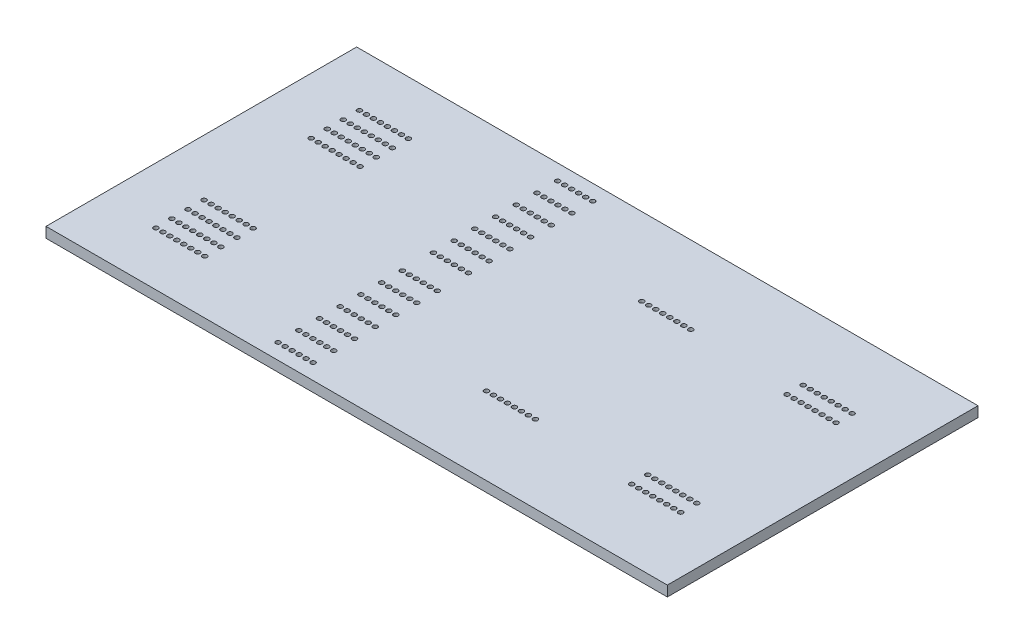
SolidWorks part; units mm, degrees
ref_plane "Plan de face" through (0, 0, 0) normal (0, 0, 1) x (1, 0, 0)
ref_plane "Plan de dessus" through (0, 0, 0) normal (0, 1, 0) x (1, 0, 0)
ref_plane "Plan de droite" through (0, 0, 0) normal (1, 0, 0) x (0, 0, -1)
sketch "Esquisse2" plane through (0, 0, 0) normal (0, 1, 0) x (1, 0, 0)
  line L1 (-60, -15) -> (60, -15)
  line L2 (-60, -15) -> (-60, 15)
  line L3 (-60, 15) -> (60, 15)
  line L4 (60, -15) -> (60, 15)
  line L5 (-60, -15) -> (60, 15) construction
  line L6 (-60, 15) -> (60, -15) construction
  point P0 (0, 0)
  dimension "D1" = 30
  dimension "D2" = 120
extrude "Boss.-Extru.1" add sketch "Esquisse2" along normal blind 2 contours L3 L4 L1 L2
sketch "Cavités" plane through (0, 0, 0) normal (0, 1, 0) x (1, 0, 0)
  line L0 (-60, -15) -> (60, -15) construction
  line L1 (-58.4, 15) -> (-30.4, 15) construction
  line L2 (-58.4, 15) -> (-58.4, -15) construction
  line L3 (-58.4, -15) -> (-30.4, -15) construction
  line L4 (-30.4, 15) -> (-30.4, -15) construction
  line L5 (-60, 15) -> (60, 15) construction
  line L6 (-28.8, 15) -> (-0.8, 15) construction
  line L7 (-28.8, 15) -> (-28.8, -15) construction
  line L8 (-28.8, -15) -> (-0.8, -15) construction
  line L9 (-0.8, 15) -> (-0.8, -15) construction
  line L10 (-30.4, 15) -> (-28.8, 15) construction
  line L11 (0.8, 15) -> (28.8, 15) construction
  line L12 (0.8, 15) -> (0.8, -15) construction
  line L13 (0.8, -15) -> (28.8, -15) construction
  line L14 (28.8, 15) -> (28.8, -15) construction
  line L15 (30.4, 15) -> (58.4, 15) construction
  line L16 (30.4, 15) -> (30.4, -15) construction
  line L17 (30.4, -15) -> (58.4, -15) construction
  line L18 (58.4, 15) -> (58.4, -15) construction
  line L19 (-0.8, 15) -> (0.8, 15) construction
  line L20 (28.8, 15) -> (30.4, 15) construction
  line L21 (-60, 15) -> (-58.4, 15) construction
  line L22 (58.4, 15) -> (60, 15) construction
  dimension "D1" = 28
  dimension "D2" = 1.6
sketch "Esquisse7" plane through (0, 2, 0) normal (0, 1, 0) x (1, 0, 0)
  line L0 (-58.4, 0) -> (-49.125, 0) construction
  line L1 (-49.125, 4.6665) -> (-39.675, 4.6665) construction
  line L2 (-49.125, 4.6665) -> (-49.125, -4.6665) construction
  line L3 (-49.125, -4.6665) -> (-39.675, -4.6665) construction
  line L4 (-39.675, 4.6665) -> (-39.675, -4.6665) construction
  line L5 (-58.4, 15) -> (-58.4, -15) construction
  line L6 (-39.675, 0) -> (-30.4, 0) construction
  line L7 (-30.4, 15) -> (-30.4, -15) construction
  dimension "D1" = 9.45
  dimension "D2" = 9.333
sketch "Esquisse8" plane through (0, 2, 0) normal (0, 1, 0) x (1, 0, 0)
  circle A0 centre (-49.125, 4.6665) radius 0.45
  dimension "D1" = 0.9
extrude "Enlèv. mat.-Extru.3" cut sketch "Esquisse8" against normal up to next
pattern_linear "Répétition linéaire4" count 8 spacing 1.35 along (1, 0, 0) count 4 spacing 3.111 along (0, 0, 1) of "Enlèv. mat.-Extru.3"
sketch "Esquisse9" plane through (0, 2, 0) normal (0, 1, 0) x (1, 0, 0)
  line L0 (-28.8, 0) -> (-18.175, 0) construction
  line L1 (-18.175, 12) -> (-11.425, 12) construction
  line L2 (-18.175, 12) -> (-18.175, -12) construction
  line L3 (-18.175, -12) -> (-11.425, -12) construction
  line L4 (-11.425, 12) -> (-11.425, -12) construction
  line L5 (-28.8, 15) -> (-28.8, -15) construction
  line L6 (-11.425, 0) -> (-0.8, 0) construction
  line L7 (-0.8, 15) -> (-0.8, -15) construction
  dimension "D1" = 6.75
  dimension "D2" = 24
sketch "Esquisse10" plane through (0, 2, 0) normal (0, 1, 0) x (1, 0, 0)
  circle A0 centre (-18.175, 12) radius 0.45
  dimension "D1" = 0.9
extrude "Enlèv. mat.-Extru.4" cut sketch "Esquisse10" against normal up to next
pattern_linear "Répétition linéaire5" count 6 spacing 1.35 along (1, 0, 0) count 7 spacing 4 along (0, 0, 1) of "Enlèv. mat.-Extru.4"
sketch "Esquisse11" plane through (0, 2, 0) normal (0, 1, 0) x (1, 0, 0)
  line L0 (0.8, 0) -> (10.075, 0) construction
  line L5 (0.8, 15) -> (0.8, -15) construction
  line L6 (19.525, 0) -> (28.8, 0) construction
  line L7 (28.8, 15) -> (28.8, -15) construction
  line L8 (10.075, 0) -> (19.525, 0) construction
  dimension "D1" = 9.45
sketch "Esquisse12" plane through (0, 2, 0) normal (0, 1, 0) x (1, 0, 0)
  circle A0 centre (10.075, 0) radius 0.45
  dimension "D1" = 0.9
extrude "Enlèv. mat.-Extru.5" cut sketch "Esquisse12" against normal up to next
pattern_linear "Répétition linéaire6" count 8 spacing 1.35 along (1, 0, 0) of "Enlèv. mat.-Extru.5"
sketch "Esquisse13" plane through (0, 2, 0) normal (0, 1, 0) x (1, 0, 0)
  line L0 (30.4, 0) -> (39.675, 0) construction
  line L1 (39.675, 1.555) -> (49.125, 1.555) construction
  line L2 (39.675, 1.555) -> (39.675, -1.555) construction
  line L3 (39.675, -1.555) -> (49.125, -1.555) construction
  line L4 (49.125, 1.555) -> (49.125, -1.555) construction
  line L5 (30.4, 15) -> (30.4, -15) construction
  line L6 (49.125, 0) -> (58.4, 0) construction
  line L7 (58.4, 15) -> (58.4, -15) construction
  dimension "D1" = 3.11
  dimension "D2" = 9.45
sketch "Esquisse14" plane through (0, 2, 0) normal (0, 1, 0) x (1, 0, 0)
  circle A0 centre (39.675, 1.555) radius 0.45
  dimension "D1" = 0.9
extrude "Enlèv. mat.-Extru.6" cut sketch "Esquisse14" against normal up to next
pattern_linear "Répétition linéaire7" count 8 spacing 1.35 along (1, 0, 0) count 2 spacing 3.11 along (0, 0, 1) of "Enlèv. mat.-Extru.6"
mirror "Symétrie1" about plane through (-60, 2, 15) normal (0, 0, -1)
